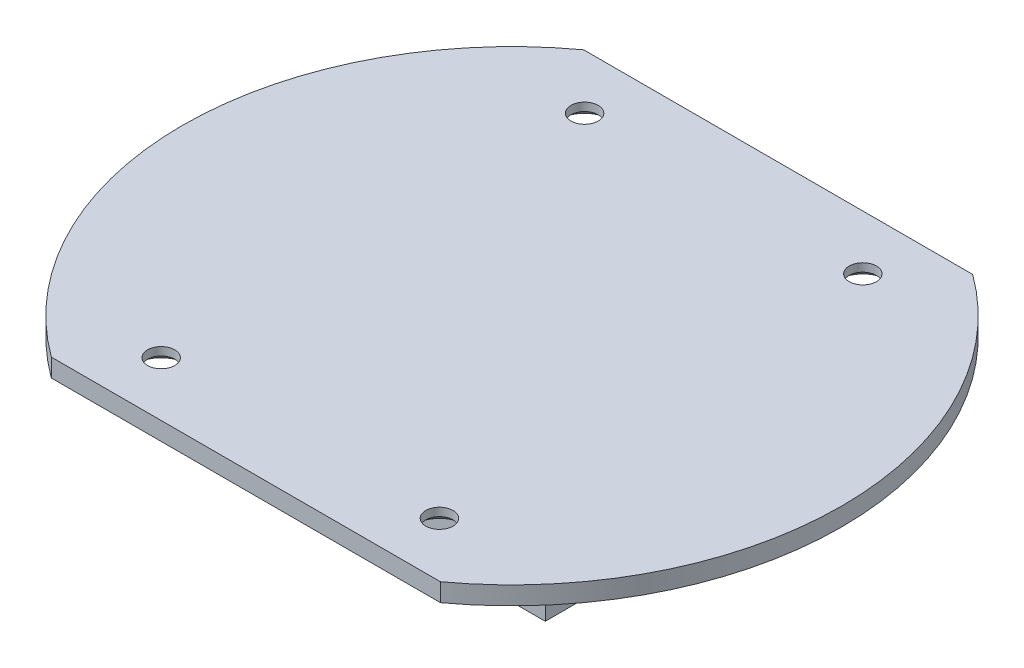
SolidWorks part; units mm, degrees
other "<dovetail_female>-<Inner Contouring>"
other "<a_base_t42>-<#8 Clearance Hole1>"
ref_plane "Front Plane" through (0, 0, 0) normal (0, 0, 1) x (1, 0, 0)
ref_plane "Top Plane" through (0, 0, 0) normal (0, 1, 0) x (1, 0, 0)
ref_plane "Right Plane" through (0, 0, 0) normal (1, 0, 0) x (0, 0, -1)
inserted part "a_base_t42"
sketch "Sketch2" plane through (0, 3, 0) normal (0, 1, 0) x (1, 0, 0)
  line L1 (32.1598, 44) -> (-32.1598, 44)
  line L2 (-32.1598, -44) -> (32.1598, -44)
  line L3 (-31.5, -42) -> (31.5, -42)
  line L4 (31.5, 42) -> (-31.5, 42)
  line L5 (-31.5, -42) -> (31.5, -42)
  line L6 (31.5, 42) -> (-31.5, 42)
  arc A0 (-32.1598, 44) -> (-32.1598, -44) centre (0, 0) ccw
  arc A1 (32.1598, -44) -> (32.1598, 44) centre (0, 0) ccw
  arc A2 (31.5, -42) -> (31.5, 42) centre (0, 0) ccw
  arc A3 (-31.5, 42) -> (-31.5, -42) centre (0, 0) ccw
  arc A4 (31.5, -42) -> (31.5, 42) centre (0, 0) ccw
  arc A5 (-31.5, 42) -> (-31.5, -42) centre (0, 0) ccw
  circle A6 centre (-40.25, 0) radius 1 construction
  circle A7 centre (40.25, 0) radius 1 construction
  circle A8 centre (-40.25, 0) radius 1
  circle A9 centre (40.25, 0) radius 1
  dimension "D1" = 0
  dimension "D2" = 2
extrude "Outer Brim" add sketch "Sketch2" against normal up to surface (3 mm away) contours L2 A1 L1 A0 M9 M12 M11 M10 | M14 | M13
hole_wizard "CSK for #8 Flat Head Machine Screw (100)1" positions "Sketch4" profile "Sketch3" countersink size "#8" standard "ANSI Inch"
sketch "Sketch4" plane through (0, 0, 0) normal (0, -1, 0) x (-1, 0, 0)
  point P0 (23, -35)
  point P3 (-23, -35)
  point P6 (-23, 35)
  point P9 (23, 35)
sketch "Sketch3" plane through (-23, 0, 35) normal (1, 0, 0) x (0, 0, -1)
  line L0 (0, 0) -> (0, 3)
  line L1 (0, 3) -> (2.2479, 3)
  line L2 (2.2479, 3) -> (2.2479, 1.6518)
  line L3 (2.2479, 1.6518) -> (4.2164, 0)
  line L5 (4.2164, 0) -> (0, 0)
  line L6 (-2.2479, 1.6518) -> (-4.2164, 0) construction
  line L11 (0, -6.35) -> (0, 107.95) construction
  dimension "Thru Hole Dia." = 4.4958
  dimension "Thru Hole Depth" = 3
  dimension "Near C'Sink Dia." = 8.4328
  dimension "Near C'Sink Angle" = 100
ref_point "Point1"
inserted part "dovetail_female"
move or copy body "Body-Move/Copy2" placed by mates yes
ref_point "Point2"
